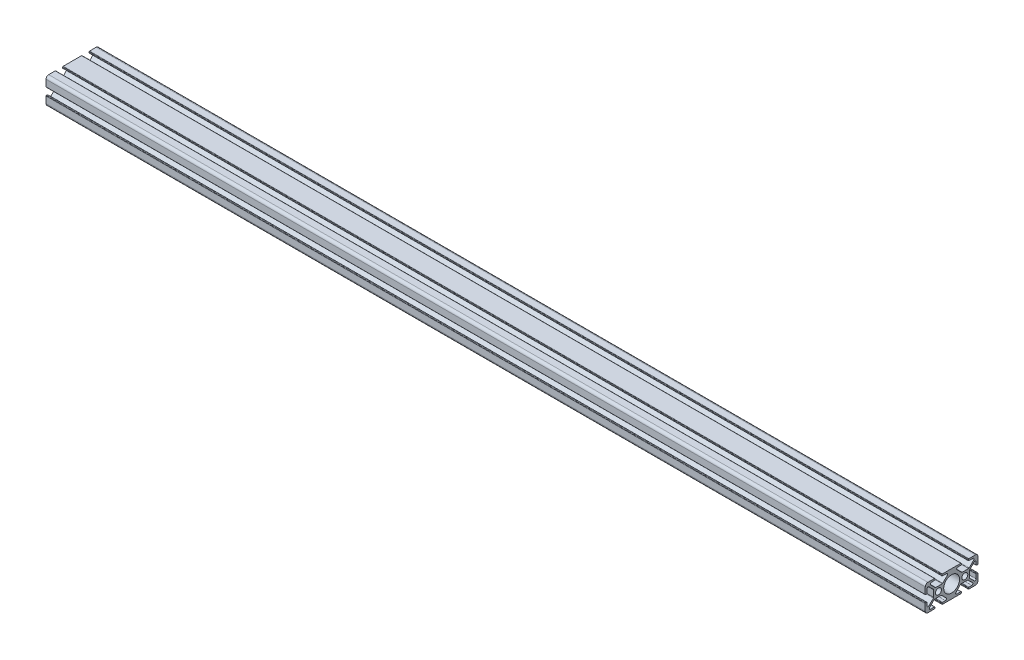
SolidWorks part; units mm, degrees
ref_plane "Ebene vorne" through (0, 0, 0) normal (0, 0, 1) x (1, 0, 0)
ref_plane "Ebene oben" through (0, 0, 0) normal (0, 1, 0) x (1, 0, 0)
ref_plane "Ebene rechts" through (0, 0, 0) normal (1, 0, 0) x (0, 0, -1)
sketch "Skizze1" plane through (0, 0, 0) normal (0, 1, 0) x (1, 0, 0)
  line L0 (0, 0) -> (1000, 0)
  dimension "D1" = 1000
other "Strukturbauteil1"
ref_plane "Ebene1" through (0, 0, 0) normal (1, 0, 0) x (0, 0, -1)
sketch "Model" plane through (0, 0, 0) normal (1, 0, 0) x (0, 0, -1)
  line L0 (10.7789, -5.4) -> (18.0211, -5.4)
  line L1 (18.7282, -5.6929) -> (23.8199, -10.7846)
  line L2 (22.9023, -13) -> (19.5, -13)
  line L3 (19, -13.5) -> (19, -14.5)
  line L4 (19.5, -15) -> (27, -15)
  line L5 (30, -12) -> (30, -4.5)
  line L6 (29.5, -4) -> (28.5, -4)
  line L7 (28, -4.5) -> (28, -9.1023)
  line L8 (25.7846, -10.0199) -> (20.6929, -4.9282)
  line L9 (20.4, -4.2211) -> (20.4, 3.0211)
  line L10 (20.6929, 3.7282) -> (25.7846, 8.8199)
  line L11 (28, 7.9023) -> (28, 4.5)
  line L12 (28.5, 4) -> (29.5, 4)
  line L13 (30, 4.5) -> (30, 12)
  line L14 (27, 15) -> (19.5, 15)
  line L15 (19, 14.5) -> (19, 13.5)
  line L16 (19.5, 13) -> (24.1023, 13)
  line L17 (25.0199, 10.7846) -> (19.9282, 5.6929)
  line L18 (19.2211, 5.4) -> (11.9789, 5.4)
  line L19 (11.2718, 5.6929) -> (6.1801, 10.7846)
  line L20 (7.0977, 13) -> (10.5, 13)
  line L21 (11, 13.5) -> (11, 14.5)
  line L22 (10.5, 15) -> (-10.5, 15)
  line L23 (-11, 14.5) -> (-11, 13.5)
  line L24 (-10.5, 13) -> (-5.8977, 13)
  line L25 (-4.9801, 10.7846) -> (-10.0718, 5.6929)
  line L26 (-10.7789, 5.4) -> (-18.0211, 5.4)
  line L27 (-18.7282, 5.6929) -> (-23.8199, 10.7846)
  line L28 (-22.9023, 13) -> (-19.5, 13)
  line L29 (-19, 13.5) -> (-19, 14.5)
  line L30 (-19.5, 15) -> (-27, 15)
  line L31 (-30, 12) -> (-30, 4.5)
  line L32 (-29.5, 4) -> (-28.5, 4)
  line L33 (-28, 4.5) -> (-28, 9.1023)
  line L34 (-25.7846, 10.0199) -> (-20.6929, 4.9282)
  line L35 (-20.4, 4.2211) -> (-20.4, -3.0211)
  line L36 (-20.6929, -3.7282) -> (-25.7846, -8.8199)
  line L37 (-28, -7.9023) -> (-28, -4.5)
  line L38 (-28.5, -4) -> (-29.5, -4)
  line L39 (-30, -4.5) -> (-30, -12)
  line L40 (-27, -15) -> (-19.5, -15)
  line L41 (-19, -14.5) -> (-19, -13.5)
  line L42 (-19.5, -13) -> (-24.1023, -13)
  line L43 (-25.0199, -10.7846) -> (-19.9282, -5.6929)
  line L44 (-19.2211, -5.4) -> (-11.9789, -5.4)
  line L45 (-11.2718, -5.6929) -> (-6.1801, -10.7846)
  line L46 (-7.0977, -13) -> (-10.5, -13)
  line L47 (-11, -13.5) -> (-11, -14.5)
  line L48 (-10.5, -15) -> (10.5, -15)
  line L49 (11, -14.5) -> (11, -13.5)
  line L50 (10.5, -13) -> (5.8977, -13)
  line L51 (4.9801, -10.7846) -> (10.0718, -5.6929)
  line L53 (-30, -15) -> (30, -15) construction
  line L54 (-30, -15) -> (-30, 15) construction
  line L55 (-30, 15) -> (30, 15) construction
  line L56 (30, -15) -> (30, 15) construction
  line L57 (-30, -15) -> (30, 15) construction
  line L58 (-30, 15) -> (30, -15) construction
  circle A0 centre (-15, 0) radius 3.4
  circle A1 centre (15, 0) radius 3.4
  circle A2 centre (0, 0) radius 9
  arc A3 (10.7789, -5.4) -> (10.0718, -5.6929) centre (10.7789, -6.4) ccw
  arc A4 (18.7282, -5.6929) -> (18.0211, -5.4) centre (18.0211, -6.4) ccw
  arc A5 (22.9023, -13) -> (23.8199, -10.7846) centre (22.9023, -11.7023) ccw
  arc A6 (19.5, -13) -> (19, -13.5) centre (19.5, -13.5) ccw
  arc A7 (19, -14.5) -> (19.5, -15) centre (19.5, -14.5) ccw
  arc A8 (27, -15) -> (30, -12) centre (27, -12) ccw
  arc A9 (30, -4.5) -> (29.5, -4) centre (29.5, -4.5) ccw
  arc A10 (28.5, -4) -> (28, -4.5) centre (28.5, -4.5) ccw
  arc A11 (25.7846, -10.0199) -> (28, -9.1023) centre (26.7023, -9.1023) ccw
  arc A12 (20.4, -4.2211) -> (20.6929, -4.9282) centre (21.4, -4.2211) ccw
  arc A13 (20.6929, 3.7282) -> (20.4, 3.0211) centre (21.4, 3.0211) ccw
  arc A14 (28, 7.9023) -> (25.7846, 8.8199) centre (26.7023, 7.9023) ccw
  arc A15 (28, 4.5) -> (28.5, 4) centre (28.5, 4.5) ccw
  arc A16 (29.5, 4) -> (30, 4.5) centre (29.5, 4.5) ccw
  arc A17 (30, 12) -> (27, 15) centre (27, 12) ccw
  arc A18 (19.5, 15) -> (19, 14.5) centre (19.5, 14.5) ccw
  arc A19 (19, 13.5) -> (19.5, 13) centre (19.5, 13.5) ccw
  arc A20 (25.0199, 10.7846) -> (24.1023, 13) centre (24.1023, 11.7023) ccw
  arc A21 (19.2211, 5.4) -> (19.9282, 5.6929) centre (19.2211, 6.4) ccw
  arc A22 (11.2718, 5.6929) -> (11.9789, 5.4) centre (11.9789, 6.4) ccw
  arc A23 (7.0977, 13) -> (6.1801, 10.7846) centre (7.0977, 11.7023) ccw
  arc A24 (10.5, 13) -> (11, 13.5) centre (10.5, 13.5) ccw
  arc A25 (11, 14.5) -> (10.5, 15) centre (10.5, 14.5) ccw
  arc A26 (-10.5, 15) -> (-11, 14.5) centre (-10.5, 14.5) ccw
  arc A27 (-11, 13.5) -> (-10.5, 13) centre (-10.5, 13.5) ccw
  arc A28 (-4.9801, 10.7846) -> (-5.8977, 13) centre (-5.8977, 11.7023) ccw
  arc A29 (-10.7789, 5.4) -> (-10.0718, 5.6929) centre (-10.7789, 6.4) ccw
  arc A30 (-18.7282, 5.6929) -> (-18.0211, 5.4) centre (-18.0211, 6.4) ccw
  arc A31 (-22.9023, 13) -> (-23.8199, 10.7846) centre (-22.9023, 11.7023) ccw
  arc A32 (-19.5, 13) -> (-19, 13.5) centre (-19.5, 13.5) ccw
  arc A33 (-19, 14.5) -> (-19.5, 15) centre (-19.5, 14.5) ccw
  arc A34 (-27, 15) -> (-30, 12) centre (-27, 12) ccw
  arc A35 (-30, 4.5) -> (-29.5, 4) centre (-29.5, 4.5) ccw
  arc A36 (-28.5, 4) -> (-28, 4.5) centre (-28.5, 4.5) ccw
  arc A37 (-25.7846, 10.0199) -> (-28, 9.1023) centre (-26.7023, 9.1023) ccw
  arc A38 (-20.4, 4.2211) -> (-20.6929, 4.9282) centre (-21.4, 4.2211) ccw
  arc A39 (-20.6929, -3.7282) -> (-20.4, -3.0211) centre (-21.4, -3.0211) ccw
  arc A40 (-28, -7.9023) -> (-25.7846, -8.8199) centre (-26.7023, -7.9023) ccw
  arc A41 (-28, -4.5) -> (-28.5, -4) centre (-28.5, -4.5) ccw
  arc A42 (-29.5, -4) -> (-30, -4.5) centre (-29.5, -4.5) ccw
  arc A43 (-30, -12) -> (-27, -15) centre (-27, -12) ccw
  arc A44 (-19.5, -15) -> (-19, -14.5) centre (-19.5, -14.5) ccw
  arc A45 (-19, -13.5) -> (-19.5, -13) centre (-19.5, -13.5) ccw
  arc A46 (-25.0199, -10.7846) -> (-24.1023, -13) centre (-24.1023, -11.7023) ccw
  arc A47 (-19.2211, -5.4) -> (-19.9282, -5.6929) centre (-19.2211, -6.4) ccw
  arc A48 (-11.2718, -5.6929) -> (-11.9789, -5.4) centre (-11.9789, -6.4) ccw
  arc A49 (-7.0977, -13) -> (-6.1801, -10.7846) centre (-7.0977, -11.7023) ccw
  arc A50 (-10.5, -13) -> (-11, -13.5) centre (-10.5, -13.5) ccw
  arc A51 (-11, -14.5) -> (-10.5, -15) centre (-10.5, -14.5) ccw
  arc A52 (10.5, -15) -> (11, -14.5) centre (10.5, -14.5) ccw
  arc A53 (11, -13.5) -> (10.5, -13) centre (10.5, -13.5) ccw
  arc A54 (4.9801, -10.7846) -> (5.8977, -13) centre (5.8977, -11.7023) ccw
  point P166 (-30, 0)
  point P167 (-15, 15)
  point P168 (15, 15)
  point P169 (30, 0)
  point P170 (15, -15)
  point P171 (-15.5662, -15)
  point P172 (0, 15)
  point P173 (0, -15)
  point P174 (0, 0)
